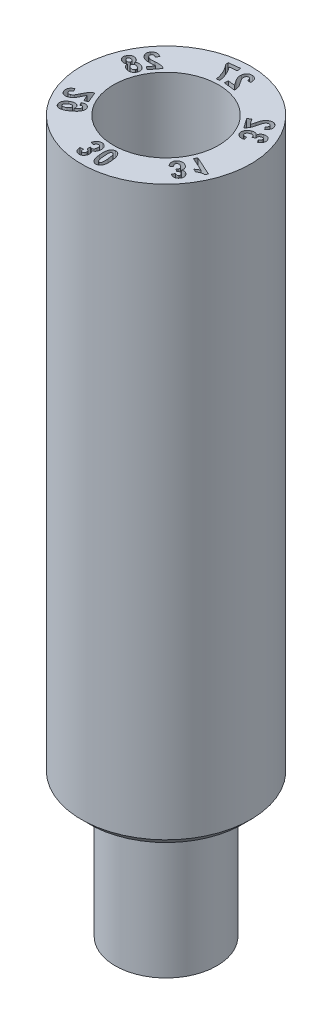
SolidWorks part; units mm, degrees
other "<M3L8-SetScrew>-<Chamfer1>" parameters "D10"=0.24
ref_plane "Front Plane" through (0, 0, 0) normal (0, 0, 1) x (1, 0, 0)
ref_plane "Top Plane" through (0, 0, 0) normal (0, 1, 0) x (1, 0, 0)
ref_plane "Right Plane" through (0, 0, 0) normal (1, 0, 0) x (0, 0, -1)
sketch "Sketch1" plane through (0, 0, 0) normal (0, 0, 1) x (1, 0, 0)
  line L0 (0, 0) -> (0, 20) construction
  line L1 (0, -2.75) -> (0, 2.75) construction
  line L2 (1.5, -17) -> (2.26, -17)
  line L3 (2.5, -16.76) -> (2.26, -17)
  line L4 (2.5, -16.76) -> (2.5, 0)
  line L5 (2.5, 0) -> (1.55, 0)
  line L6 (1.55, 0) -> (1.55, -2.8)
  line L7 (1.55, -2.8) -> (0.8, -2.8)
  line L8 (0.8, -2.8) -> (0.8, -13)
  line L9 (0.8, -13) -> (1.5, -13)
  line L10 (1.5, -13) -> (1.5, -17)
  dimension "D1" = 2.8
  dimension "D2" = 4
  dimension "D3" = 1.6
  dimension "D4" = 3.1
  dimension "D5" = 5
  dimension "D6" = 3
  dimension "D7" = 0.24
  dimension "D8" = 45
  dimension "D9" = 17
revolve "Revolve1" add sketch "Sketch1" angle 360 about L0
sketch "Sketch2" plane through (0, 0, 0) normal (0, 1, 0) x (1, 0, 0)
  line L0 (0, 0) -> (0, 2.1482) construction
  line L1 (0, 0) -> (1.8604, 1.0741) construction
  line L2 (0, 0) -> (1.8604, -1.0741) construction
  line L3 (0, 0) -> (0, -2.1482) construction
  line L4 (0, 0) -> (-1.8604, -1.0741) construction
  line L5 (0, 0) -> (-1.8604, 1.0741) construction
  arc A0 (0.392, 1.6439) -> (1.2877, 1.0945) centre (0, 0) ccw construction
  text T0 "27     28     29     30     31     32" font "Arial Narrow" height 0.62
  point P12 (0, 0)
  point P17 (0, 0)
  point P18 (0, 0)
  point P21 (0, 0)
  dimension "D1" = 3.38
  dimension "D2" = 6
extrude "Cut-Extrude1" cut sketch "Sketch2" against normal blind 0.25
inserted part "M3L8-SetScrew"
move or copy body "Body-Move/Copy2" placed by mates yes
other "Distance1" parameters "D1"=4
